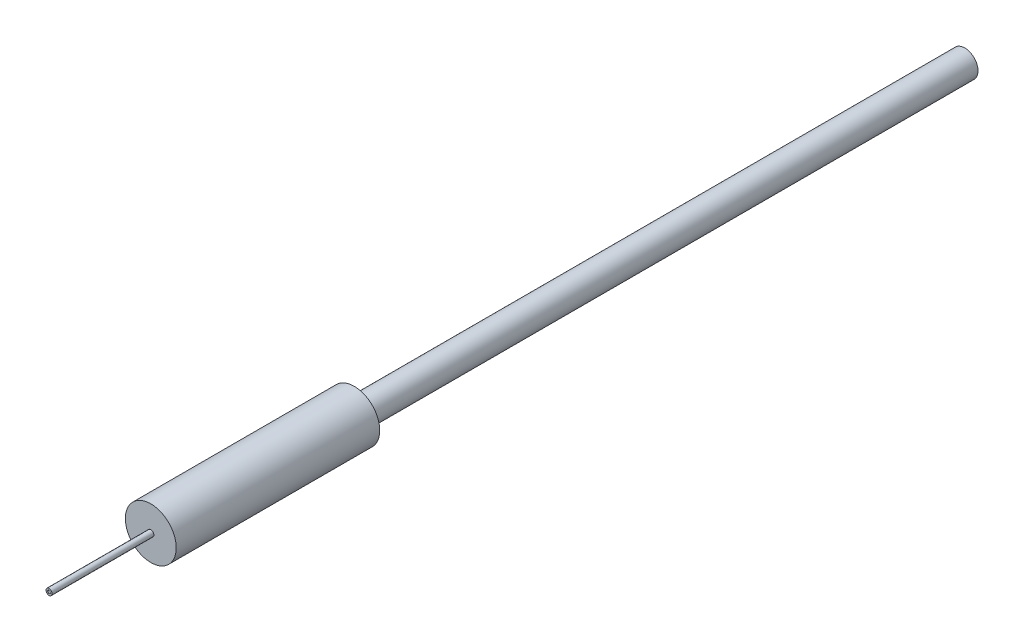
SolidWorks part; units mm, degrees
ref_plane "前视基准面" through (0, 0, 0) normal (0, 0, 1) x (1, 0, 0)
ref_plane "上视基准面" through (0, 0, 0) normal (0, 1, 0) x (1, 0, 0)
ref_plane "右视基准面" through (0, 0, 0) normal (1, 0, 0) x (0, 0, -1)
sketch "草图1" plane through (0, 0, 0) normal (0, 0, 1) x (1, 0, 0)
  circle A0 centre (0, 0) radius 1.25
  dimension "D1" = 2.5
extrude "凸台-拉伸1" add sketch "草图1" against normal blind 10
sketch "草图2" plane through (0, 0, 0) normal (0, 0, 1) x (1, 0, 0)
  circle A0 centre (0, 0) radius 0.15
  dimension "D1" = 0.3
extrude "凸台-拉伸2" add sketch "草图2" along normal blind 5
sketch "草图3" plane through (0, 0, -10) normal (0, 0, -1) x (-1, 0, 0)
  circle A0 centre (0, 0) radius 0.65
  dimension "D1" = 1.3
extrude "凸台-拉伸3" add sketch "草图3" along normal blind 30
sketch "草图4" plane through (0, 0, 5) normal (0, 0, 1) x (1, 0, 0)
  circle A0 centre (0, 0) radius 0.0625
  circle A1 centre (0, 0) radius 0.0675
  dimension "D1" = 0.135
  dimension "D2" = 0.125
extrude "切除-拉伸1" cut sketch "草图4" against normal blind 0.1
